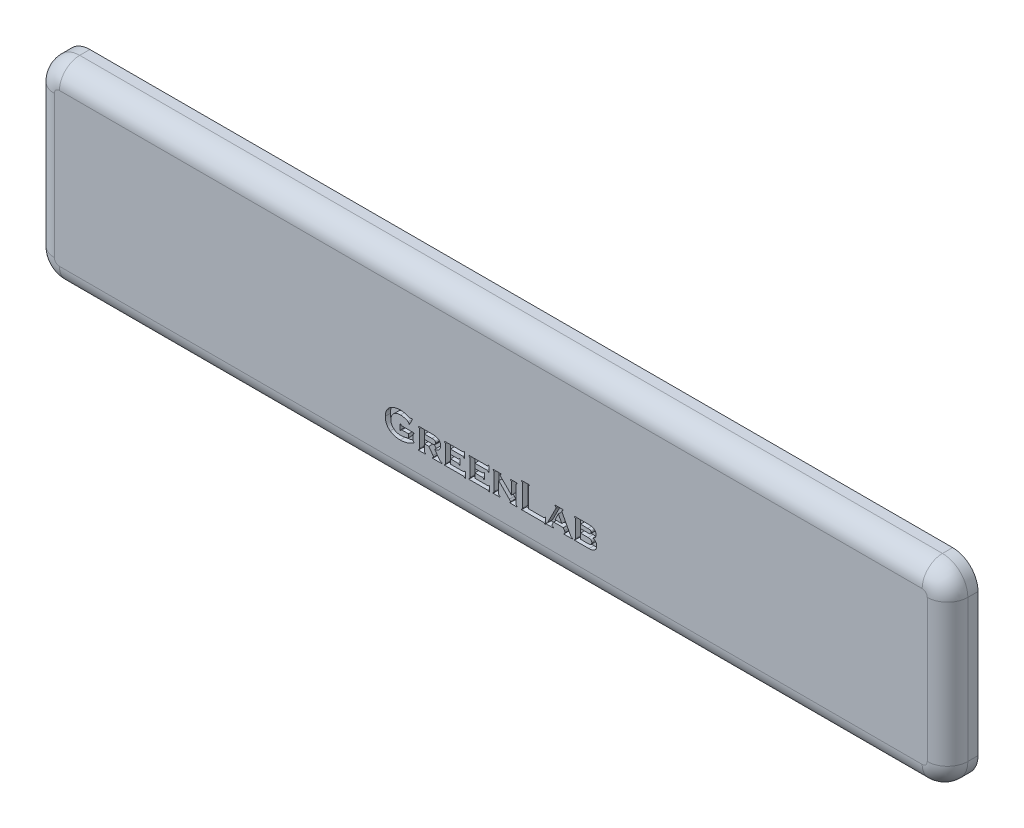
SolidWorks part; units mm, degrees
ref_plane "Front Plane" through (0, 0, 0) normal (0, 0, 1) x (1, 0, 0)
ref_plane "Top Plane" through (0, 0, 0) normal (0, 1, 0) x (1, 0, 0)
ref_plane "Right Plane" through (0, 0, 0) normal (1, 0, 0) x (0, 0, -1)
ref_plane "Plane1" through (0, 0, 3) normal (0, 0, 1) x (1, 0, 0)
sketch "Sketch1" plane through (0, 0, 3) normal (0, 0, 1) x (1, 0, 0)
  line L0 (-34, -9.5) -> (56, -9.5)
  line L1 (56, -9.5) -> (56, 9.5)
  line L2 (56, 9.5) -> (-34, 9.5)
  line L3 (-34, 9.5) -> (-34, -9.5)
  dimension "D1" = 90
  dimension "D2" = 19
extrude "Boss-Extrude1" add sketch "Sketch1" against normal blind 3
fillet "Fillet1" radius 2.5 4 edges at (56, 9.5, 1.5) (56, -9.5, 1.5) (-34, 9.5, 1.5) (-34, -9.5, 1.5)
fillet "Fillet2" radius 2 8 edges at (-33.2678, 8.7678, 3) (11, 9.5, 3) (-34, 0, 3) (55.2678, 8.7678, 3) (-33.2678, -8.7678, 3) (56, 0, 3) (11, -9.5, 3) (55.2678, -8.7678, 3)
sketch "Sketch2" plane through (0, 0, 3) normal (0, 0, 1) x (1, 0, 0)
  line L0 (11, -7.5) -> (11, -50007.5) construction
  line L1 (-31.5, -7.5) -> (53.5, -7.5) construction
  line L2 (-15.5032, -5.5) -> (37.5032, -5.5) construction
  text T0 "GreenLab" font "Copperplate Gothic Bold" height 2.5
  point P4 (11, -7.5)
  point P8 (11, -5.5)
  dimension "D1" = 2
extrude "Cut-Extrude1" cut sketch "Sketch2" against normal blind 0.5
